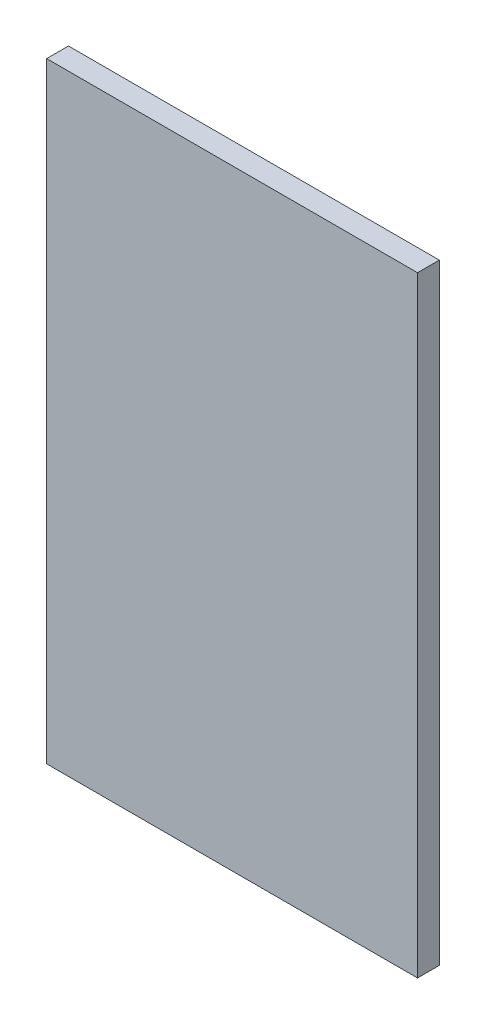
SolidWorks part; units mm, degrees
ref_plane "Plan de face" through (0, 0, 0) normal (0, 0, 1) x (1, 0, 0)
ref_plane "Plan de dessus" through (0, 0, 0) normal (0, 1, 0) x (1, 0, 0)
ref_plane "Plan de droite" through (0, 0, 0) normal (1, 0, 0) x (0, 0, -1)
sketch "Esquisse1" plane through (0, 0, 0) normal (0, 0, 1) x (1, 0, 0)
  line L1 (0, 0) -> (85, 0)
  line L2 (0, 0) -> (0, 140)
  line L3 (0, 140) -> (85, 140)
  line L4 (85, 0) -> (85, 140)
  dimension "D1" = 85
  dimension "D2" = 140
extrude "Boss.-Extru.1" add sketch "Esquisse1" along normal blind 5
